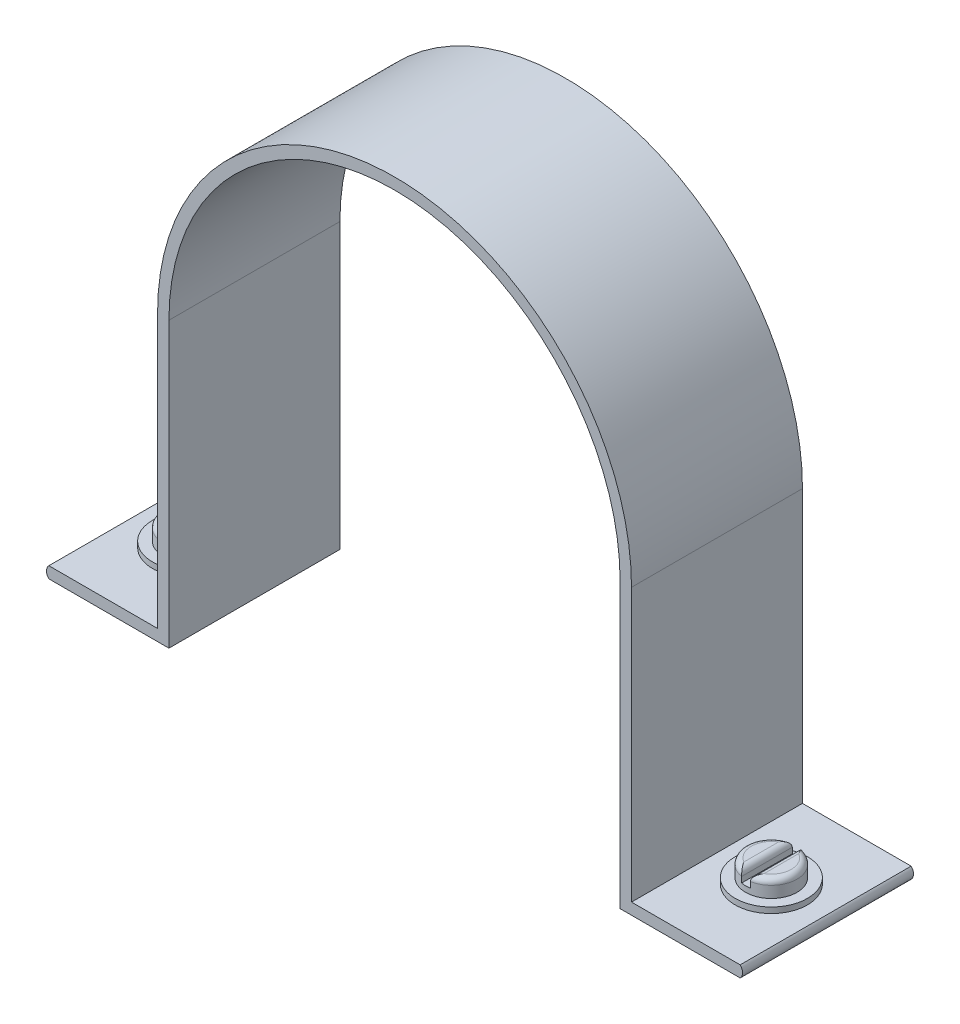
SolidWorks part; units mm, degrees
ref_plane "Front Plane" through (0, 0, 0) normal (0, 0, 1) x (1, 0, 0)
ref_plane "Top Plane" through (0, 0, 0) normal (0, 1, 0) x (1, 0, 0)
ref_plane "Right Plane" through (0, 0, 0) normal (1, 0, 0) x (0, 0, -1)
sketch "Sketch1" plane through (0, 0, 0) normal (0, 0, 1) x (1, 0, 0)
  line L0 (-39.5838, 2) -> (-39.5838, -47.8384)
  line L1 (-39.5838, -47.8384) -> (-60.6534, -47.8384)
  line L2 (39.5838, 2) -> (39.5838, -47.8384)
  line L3 (39.5838, -47.8384) -> (60.6534, -47.8384)
  line L4 (41.5838, -45.8384) -> (60.6534, -45.8384)
  line L5 (41.5838, 2) -> (41.5838, -45.8384)
  line L6 (-41.5838, 2) -> (-41.5838, -45.8384)
  line L7 (-41.5838, -45.8384) -> (-60.6534, -45.8384)
  line L8 (0, 2) -> (0, -4.0482) construction
  arc A0 (39.5838, 2) -> (-39.5838, 2) centre (0, 2) ccw
  arc A1 (41.5838, 2) -> (-41.5838, 2) centre (0, 2) ccw
  arc A2 (-60.6534, -47.8384) -> (-60.6534, -45.8384) centre (-59.6534, -46.8384) cw
  arc A3 (60.6534, -47.8384) -> (60.6534, -45.8384) centre (59.6534, -46.8384) ccw
extrude "Boss-Extrude1" add sketch "Sketch1" along normal blind 30
sketch "Sketch2" plane through (0, -45.8384, 0) normal (0, 1, 0) x (1, 0, 0)
  line L0 (0, 0) -> (0, -15) construction
  circle A0 centre (51.1186, -15) radius 6.3372
  circle A1 centre (-51.1186, -15) radius 6.3372
extrude "Boss-Extrude2" add sketch "Sketch2" along normal blind 1
sketch "Sketch3" plane through (0, -44.8384, 0) normal (0, 1, 0) x (1, 0, 0)
  line L0 (0, 0) -> (0, -10.4884) construction
  line L1 (41.5838, 0) -> (-41.5838, 0) construction
  circle A0 centre (51.1186, -15) radius 4.5116
  circle A1 centre (-51.1186, -15) radius 4.5116
extrude "Boss-Extrude3" add sketch "Sketch3" along normal blind 3
sketch "Sketch4" plane through (0, -41.8384, 0) normal (0, 1, 0) x (1, 0, 0)
  line L0 (51.1186, -10.4884) -> (51.1186, -19.5116) construction
  line L1 (51.8864, -10.4884) -> (51.8864, -19.5116)
  line L2 (50.3508, -10.4884) -> (50.3508, -19.5116)
  line L3 (0, 0) -> (0, -8.9512) construction
  line L4 (-51.1186, -10.4884) -> (-51.1186, -19.5116) construction
  line L5 (-51.8864, -10.4884) -> (-51.8864, -19.5116)
  line L6 (-50.3508, -10.4884) -> (-50.3508, -19.5116)
  circle A0 centre (51.1186, -15) radius 4.5116 construction
  circle A1 centre (51.1186, -15) radius 4.5116 construction
  arc A2 (51.8864, -10.4884) -> (50.3508, -10.4884) centre (51.1186, -10.4884) ccw
  arc A3 (50.3508, -19.5116) -> (51.8864, -19.5116) centre (51.1186, -19.5116) ccw
  arc A4 (-51.8864, -10.4884) -> (-50.3508, -10.4884) centre (-51.1186, -10.4884) cw
  arc A5 (-50.3508, -19.5116) -> (-51.8864, -19.5116) centre (-51.1186, -19.5116) cw
  point P6 (51.1186, -15)
  point P16 (-51.1186, -15)
extrude "Cut-Extrude1" cut sketch "Sketch4" against normal blind 2
fillet "Fillet1" radius 1 4 edges at (46.607, -41.8384, 15) (50.3508, -41.8384, 15) (55.6303, -41.8384, 15) (51.8864, -41.8384, 15)
fillet "Fillet2" radius 1 4 edges at (-51.8864, -41.8384, 15) (-55.6303, -41.8384, 15) (-50.3508, -41.8384, 15) (-46.607, -41.8384, 15)
